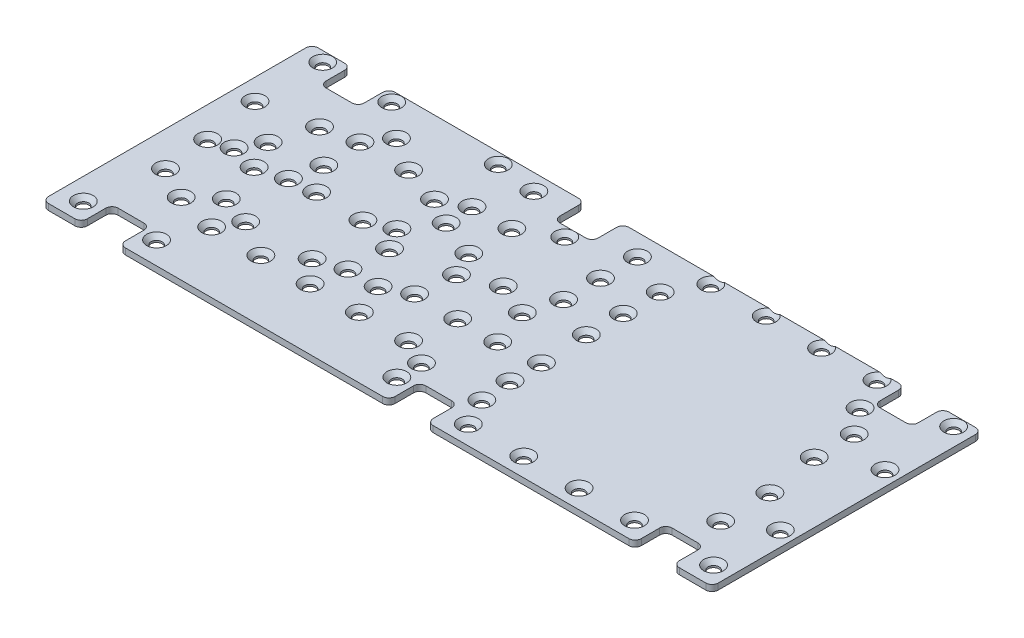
SolidWorks part; units mm, degrees
ref_plane "前视基准面" through (0, 0, 0) normal (0, 0, 1) x (1, 0, 0)
ref_plane "上视基准面" through (0, 0, 0) normal (0, 1, 0) x (1, 0, 0)
ref_plane "右视基准面" through (0, 0, 0) normal (1, 0, 0) x (0, 0, -1)
other "Configuration Table"
sketch "草图1" plane through (0, 0, 0) normal (0, 1, 0) x (1, 0, 0)
  line L0 (14.1, 0.6) -> (55.9, 0.6)
  line L1 (56.9, 1.6) -> (56.9, 4.6)
  line L2 (57.9, 5.6) -> (62.1, 5.6)
  line L3 (63.1, 4.6) -> (63.1, 1.6)
  line L4 (64.1, 0.6) -> (95.9, 0.6)
  line L5 (96.9, 1.6) -> (96.9, 4.6)
  line L6 (97.9, 5.6) -> (102.1, 5.6)
  line L7 (103.1, 4.6) -> (103.1, 1.6)
  line L8 (104.1, 0.6) -> (108.4, 0.6)
  line L9 (109.4, 1.6) -> (109.4, 43.4)
  line L10 (108.4, 44.4) -> (104.1, 44.4)
  line L11 (103.1, 43.4) -> (103.1, 40.4)
  line L12 (102.1, 39.4) -> (97.9, 39.4)
  line L13 (96.9, 40.4) -> (96.9, 43.4)
  line L14 (95.9, 44.4) -> (52.1, 44.4)
  line L15 (51.1, 43.4) -> (51.1, 40.4)
  line L16 (50.1, 39.4) -> (45.9, 39.4)
  line L17 (44.9, 40.4) -> (44.9, 43.4)
  line L18 (43.9, 44.4) -> (14.1, 44.4)
  line L19 (13.1, 43.4) -> (13.1, 40.4)
  line L20 (12.1, 39.4) -> (7.9, 39.4)
  line L21 (6.9, 40.4) -> (6.9, 43.4)
  line L22 (5.9, 44.4) -> (1.6, 44.4)
  line L23 (0.6, 43.4) -> (0.6, 1.6)
  line L24 (1.6, 0.6) -> (5.9, 0.6)
  line L25 (6.9, 1.6) -> (6.9, 4.6)
  line L26 (7.9, 5.6) -> (12.1, 5.6)
  line L27 (13.1, 4.6) -> (13.1, 1.6)
  arc A0 (55.9, 0.6) -> (56.9, 1.6) centre (55.9, 1.6) ccw
  arc A1 (57.9, 5.6) -> (56.9, 4.6) centre (57.9, 4.6) ccw
  arc A2 (63.1, 4.6) -> (62.1, 5.6) centre (62.1, 4.6) ccw
  arc A3 (63.1, 1.6) -> (64.1, 0.6) centre (64.1, 1.6) ccw
  arc A4 (95.9, 0.6) -> (96.9, 1.6) centre (95.9, 1.6) ccw
  arc A5 (97.9, 5.6) -> (96.9, 4.6) centre (97.9, 4.6) ccw
  arc A6 (103.1, 4.6) -> (102.1, 5.6) centre (102.1, 4.6) ccw
  arc A7 (103.1, 1.6) -> (104.1, 0.6) centre (104.1, 1.6) ccw
  arc A8 (108.4, 0.6) -> (109.4, 1.6) centre (108.4, 1.6) ccw
  arc A9 (109.4, 43.4) -> (108.4, 44.4) centre (108.4, 43.4) ccw
  arc A10 (104.1, 44.4) -> (103.1, 43.4) centre (104.1, 43.4) ccw
  arc A11 (102.1, 39.4) -> (103.1, 40.4) centre (102.1, 40.4) ccw
  arc A12 (96.9, 40.4) -> (97.9, 39.4) centre (97.9, 40.4) ccw
  arc A13 (96.9, 43.4) -> (95.9, 44.4) centre (95.9, 43.4) ccw
  arc A14 (52.1, 44.4) -> (51.1, 43.4) centre (52.1, 43.4) ccw
  arc A15 (50.1, 39.4) -> (51.1, 40.4) centre (50.1, 40.4) ccw
  arc A16 (44.9, 40.4) -> (45.9, 39.4) centre (45.9, 40.4) ccw
  arc A17 (44.9, 43.4) -> (43.9, 44.4) centre (43.9, 43.4) ccw
  arc A18 (14.1, 44.4) -> (13.1, 43.4) centre (14.1, 43.4) ccw
  arc A19 (12.1, 39.4) -> (13.1, 40.4) centre (12.1, 40.4) ccw
  arc A20 (6.9, 40.4) -> (7.9, 39.4) centre (7.9, 40.4) ccw
  arc A21 (6.9, 43.4) -> (5.9, 44.4) centre (5.9, 43.4) ccw
  arc A22 (1.6, 44.4) -> (0.6, 43.4) centre (1.6, 43.4) ccw
  arc A23 (0.6, 1.6) -> (1.6, 0.6) centre (1.6, 1.6) ccw
  arc A24 (5.9, 0.6) -> (6.9, 1.6) centre (5.9, 1.6) ccw
  arc A25 (7.9, 5.6) -> (6.9, 4.6) centre (7.9, 4.6) ccw
  arc A26 (13.1, 4.6) -> (12.1, 5.6) centre (12.1, 4.6) ccw
  arc A27 (13.1, 1.6) -> (14.1, 0.6) centre (14.1, 1.6) ccw
extrude "凸台-拉伸1" add sketch "草图1" along normal blind 1
sketch "草图2" plane through (0, 1, 0) normal (0, 1, 0) x (1, 0, 0)
  line L0 (1.6, 0.6) -> (5.9, 0.6) construction
  line L1 (0.6, 43.4) -> (0.6, 1.6) construction
  point P0 (4.1, 3.75)
  dimension "D1" = 3.15
  dimension "D2" = 3.5
hole_wizard "M1.6 锥坑平头螺钉的锥形沉头孔1" positions "草图2" profile "草图3" countersink size "M1.6" standard "ISO"
sketch "草图3" plane through (4.1, 1, -3.75) normal (1, 0, 0) x (0, 0, 1)
  line L0 (0, 0) -> (0, 4.7908)
  line L1 (0, 4.7908) -> (0.9, 4.25)
  line L2 (0.9, 4.25) -> (0.9, 0.7)
  line L3 (0.9, 0.7) -> (1.6, 0)
  line L5 (1.6, 0) -> (0, 0)
  line L6 (-0.9, 0.7) -> (-1.6, 0) construction
  line L10 (0, 4.7908) -> (-0.9, 4.25) construction
  line L11 (0, -6.35) -> (0, 107.95) construction
  dimension "孔直径" = 1.8
  dimension "孔深度" = 4.25
  dimension "近端锥形沉头孔直径" = 3.2
  dimension "近端锥形沉头孔角度" = 90
  dimension "导头角度" = 118
sketch "草图4" plane through (0, 1, 0) normal (0, 1, 0) x (1, 0, 0)
  point P3 (4, 42.75)
  point P4 (4, 31.75)
  point P5 (5.5, 22.55)
  point P6 (8.85, 23.5)
  point P7 (10.825, 27.05)
  point P8 (13.2, 22.4)
  point P9 (17.575, 23.6)
  point P10 (18.575, 28.35)
  point P11 (12.825, 33.4)
  point P12 (18.25, 34.55)
  point P13 (20.7, 38.025)
  point P14 (15.2, 42.75)
  point P15 (32.625, 42.65)
  point P16 (26.15, 34.55)
  point P17 (32.35, 32.55)
  point P18 (33.45, 25.35)
  point P19 (29.475, 23.8)
  point P20 (35.65, 21.95)
  point P21 (6.2, 15)
  point P22 (11.5, 12.25)
  point P23 (15.375, 15.7)
  point P24 (20.175, 14.05)
  point P25 (18.15, 10.55)
  point P26 (15.5, 4.2538)
  point P27 (26.15, 10.55)
  point P28 (30.775, 14.25)
  point P29 (34.15, 10.55)
  point P30 (35.15, 15.7)
  point P31 (40.05, 15.7)
  point P32 (42.15, 10.55)
  point P33 (36.65, 30.15)
  point P34 (36.45, 34.55)
  point P35 (42.75, 34.725)
  point P36 (39.3, 41.75)
  point P37 (44.75, 23.725)
  point P38 (42.75, 27.725)
  point P39 (44.05, 17.625)
  point P40 (48.25, 37.825)
  point P41 (50.15, 25.925)
  point P42 (51.05, 17.625)
  point P43 (50.15, 10.55)
  point P44 (54.34, 4.45)
  point P45 (54.34, 8.45)
  point P46 (57.55, 17.625)
  point P47 (55.45, 23.725)
  point P48 (56.95, 28.925)
  point P49 (56.95, 34.925)
  point P50 (56.95, 40.925)
  point P51 (63.75, 37.825)
  point P52 (66.75, 43.05)
  point P53 (63.75, 31.825)
  point P54 (63.75, 25.825)
  point P55 (64.05, 18.225)
  point P56 (64.05, 13.125)
  point P57 (64.45, 8.15)
  point P58 (66.75, 3.65)
  point P59 (75.75, 3.65)
  point P60 (84.75, 3.65)
  point P61 (93.75, 3.65)
  point P62 (100.9, 10.5)
  point P63 (100.9, 18.5)
  point P64 (107, 14.1)
  point P65 (106.5, 3.75)
  point P66 (99.5, 27.1)
  point P67 (107, 31.1)
  point P68 (99.5, 33.6)
  point P69 (96.3, 37.75)
  point P70 (106.5, 42.75)
  point P71 (93.75, 43.05)
  point P72 (84.75, 43.05)
pattern_sketch "草图阵列1" of "M1.6 锥坑平头螺钉的锥形沉头孔1"
sketch "草图5" plane through (0, 1, 0) normal (0, 1, 0) x (1, 0, 0)
  circle A0 centre (66.75, 43.05) radius 0.9 construction
  circle A1 centre (17.575, 23.6) radius 0.9 construction
  point P0 (75.75, 43.05)
  point P2 (21.775, 23.98)
  point P5 (0, 0)
  point P8 (0, 0)
  point P11 (21.775, 26.3501)
  dimension "D1" = 9
  dimension "D2" = 0
  dimension "D3" = 4.2
  dimension "D4" = 0.38
hole_wizard "M1.6 锥坑平头螺钉的锥形沉头孔2" positions "草图5" profile "草图6" countersink size "M1.6" standard "ISO"
sketch "草图6" plane through (75.75, 1, -43.05) normal (1, 0, 0) x (0, 0, 1)
  line L0 (0, 0) -> (0, 4.7908)
  line L1 (0, 4.7908) -> (0.9, 4.25)
  line L2 (0.9, 4.25) -> (0.9, 0.7)
  line L3 (0.9, 0.7) -> (1.6, 0)
  line L5 (1.6, 0) -> (0, 0)
  line L6 (-0.9, 0.7) -> (-1.6, 0) construction
  line L10 (0, 4.7908) -> (-0.9, 4.25) construction
  line L11 (0, -6.35) -> (0, 107.95) construction
  dimension "孔直径" = 1.8
  dimension "孔深度" = 4.25
  dimension "近端锥形沉头孔直径" = 3.2
  dimension "近端锥形沉头孔角度" = 90
  dimension "导头角度" = 118
